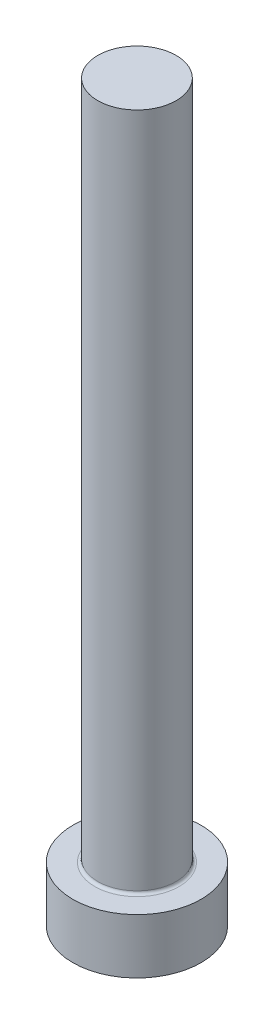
SolidWorks part; units mm, degrees
ref_plane "Front Plane" through (0, 0, 0) normal (0, 0, 1) x (1, 0, 0)
ref_plane "Top Plane" through (0, 0, 0) normal (0, 1, 0) x (1, 0, 0)
ref_plane "Right Plane" through (0, 0, 0) normal (1, 0, 0) x (0, 0, -1)
sketch "Sketch1" plane through (0, 0, 0) normal (0, 0, 1) x (1, 0, 0)
  line L0 (0, 0) -> (0, -1.906) construction
  line L1 (0, 0) -> (5.5499, 0)
  line L2 (5.5499, 0) -> (5.5499, 4.7498)
  line L3 (5.5499, 4.7498) -> (3.6449, 4.7498)
  line L4 (3.3909, 5.0038) -> (3.3909, 63.5)
  line L6 (0, 63.5) -> (3.3909, 63.5)
  line L7 (0, 63.5) -> (0, 0)
  arc A0 (3.6449, 4.7498) -> (3.3909, 5.0038) centre (3.6449, 5.0038) cw
  dimension "D5" = 0.254
  dimension "D" = 6.7818
  dimension "H" = 11.0998
  dimension "D4" = 63.5
  dimension "T" = 4.7498
revolve "Revolve3" add sketch "Sketch1" angle 360 about L0
